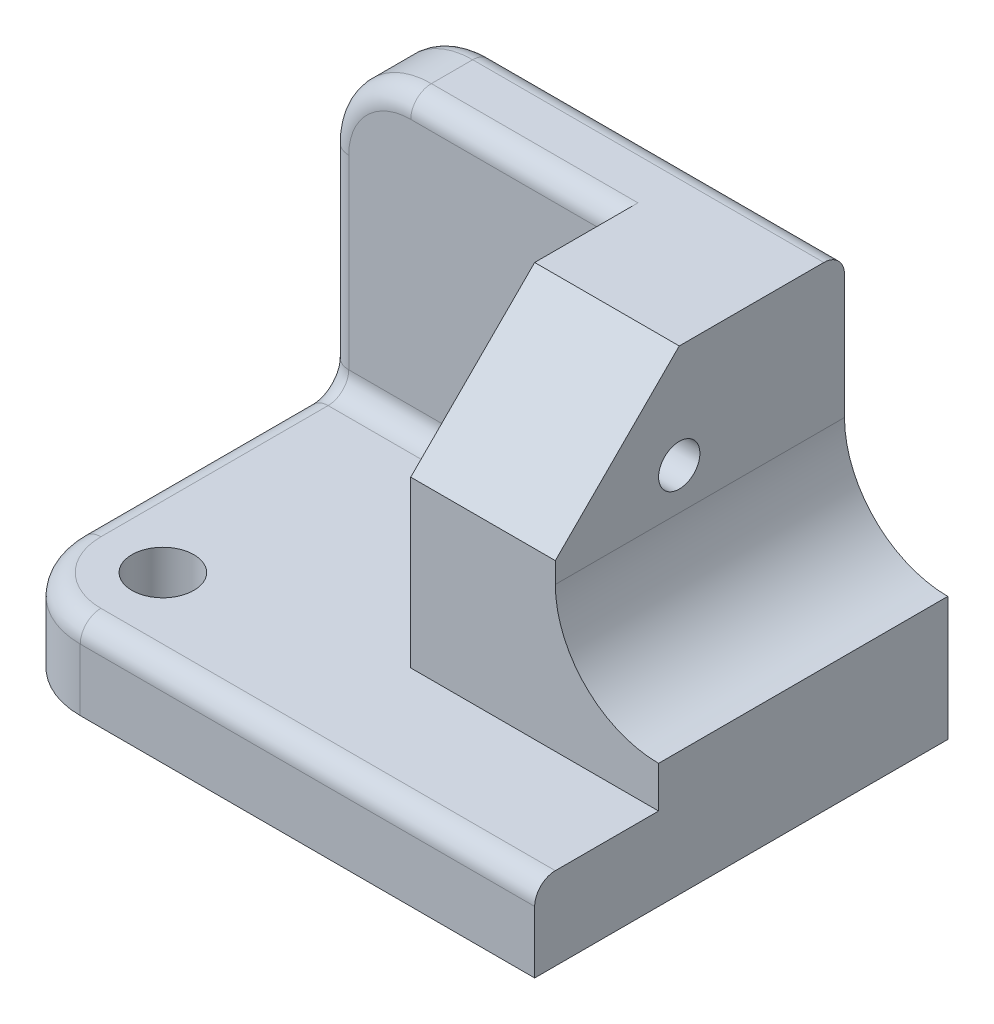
SolidWorks part; units mm, degrees
ref_plane "Front Plane" through (0, 0, 0) normal (0, 0, 1) x (1, 0, 0)
ref_plane "Top Plane" through (0, 0, 0) normal (0, 1, 0) x (1, 0, 0)
ref_plane "Right Plane" through (0, 0, 0) normal (1, 0, 0) x (0, 0, -1)
sketch "Sketch1" plane through (0, 0, 0) normal (0, 1, 0) x (1, 0, 0)
  line L1 (-65, -50) -> (65, -50)
  line L2 (-65, -50) -> (-65, 50)
  line L3 (-65, 50) -> (65, 50)
  line L4 (65, -50) -> (65, 50)
  line L5 (-65, -50) -> (65, 50) construction
  line L6 (-65, 50) -> (65, -50) construction
  point P0 (0, 0)
  dimension "D1" = 100
  dimension "D2" = 130
extrude "Boss-Extrude1" add sketch "Sketch1" along normal blind 20
sketch "Sketch2" plane through (0, 20, 0) normal (0, 1, 0) x (1, 0, 0)
  line L0 (65, -50) -> (65, 50) construction
  line L1 (-65, 50) -> (65, 50)
  line L2 (-65, 50) -> (-65, 30)
  line L3 (-65, 30) -> (65, 30)
  line L4 (65, 50) -> (65, 30)
  dimension "D1" = 20
extrude "Boss-Extrude2" add sketch "Sketch2" along normal blind 70
fillet "Fillet1" radius 20 2 edges at (-65, 10, 50) (-65, 90, -40)
sketch "Sketch3" plane through (0, 0, -30) normal (0, 0, 1) x (1, 0, 0)
  line L0 (-45, 90) -> (65, 90) construction
  line L1 (65, 20) -> (5, 20)
  line L2 (65, 20) -> (65, 90)
  line L3 (65, 90) -> (5, 90)
  line L4 (5, 20) -> (5, 90)
  dimension "D1" = 60
extrude "Boss-Extrude3" add sketch "Sketch3" along normal blind 50
sketch "Sketch4" plane through (0, 0, 20) normal (0, 0, 1) x (1, 0, 0)
  line L0 (40, 90) -> (40, 55)
  line L1 (65, 90) -> (5, 90) construction
  line L2 (65, 20) -> (65, 90) construction
  line L7 (65, 20) -> (65, 90)
  line L8 (65, 90) -> (5, 90)
  line L9 (5, 90) -> (5, 20)
  line L10 (5, 20) -> (65, 20)
  line L11 (65, 30) -> (65, 90)
  line L12 (65, 90) -> (40, 90)
  arc A0 (40, 55) -> (65, 30) centre (65, 55) ccw
  dimension "D2" = 25
  dimension "D1" = 25
  dimension "D3" = 35
  dimension "D4" = 0
extrude "Cut-Extrude1" cut sketch "Sketch4" against normal through all
chamfer "Chamfer1" distance 30 angle 45 1 edges at (22.5, 90, 20)
hole_wizard "Ø10.0 (10) Diameter Hole1" positions "Sketch6" profile "Sketch5" hole size "Ø10.0" standard "ANSI Metric"
sketch "Sketch6" plane through (5, 0, 0) normal (-1, 0, 0) x (0, 0, 1)
  line L0 (20, 60) -> (20, 20) construction
  line L1 (20, 20) -> (-30, 20) construction
  point P0 (-10, 65)
  dimension "D1" = 30
  dimension "D2" = 45
sketch "Sketch5" plane through (5, 65, -10) normal (0, 1, 0) x (0, 0, 1)
  line L0 (0, 0) -> (0, 60)
  line L1 (0, 60) -> (5, 60)
  line L2 (5, 60) -> (5, 0)
  line L5 (5, 0) -> (0, 0)
  line L11 (0, -6.35) -> (0, 107.95) construction
  dimension "Thru Hole Dia." = 10
  dimension "Thru Hole Depth" = 60
hole_wizard "Ø15.0 (15) Diameter Hole1" positions "Sketch8" profile "Sketch7" hole size "Ø15.0" standard "ANSI Metric"
sketch "Sketch8" plane through (0, 20, 0) normal (0, 1, 0) x (1, 0, 0)
  point P0 (-45, -30)
sketch "Sketch7" plane through (-45, 20, 30) normal (1, 0, 0) x (0, 0, 1)
  line L0 (0, 0) -> (0, 20)
  line L1 (0, 20) -> (7.5, 20)
  line L2 (7.5, 20) -> (7.5, 0)
  line L5 (7.5, 0) -> (0, 0)
  line L11 (0, -6.35) -> (0, 107.95) construction
  dimension "Thru Hole Dia." = 15
  dimension "Thru Hole Depth" = 20
fillet "Fillet2" radius 5 10 edges at (10, 20, 50) (-65, 35, -50) (-2.5, 90, -50) (-20, 90, -30) (-59.1421, 20, 44.1421) (-59.1421, 84.1421, -50) (-59.1421, 84.1421, -30)
